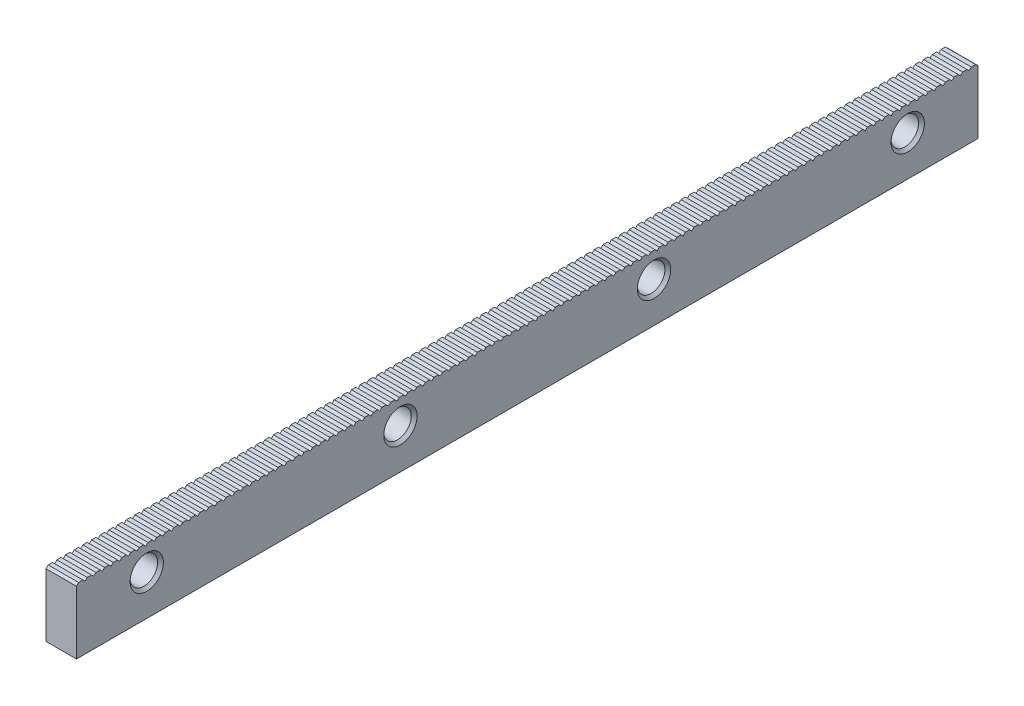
SolidWorks part; units mm, degrees
ref_plane "Front Plane" through (0, 0, 0) normal (0, 0, 1) x (1, 0, 0)
ref_plane "Top Plane" through (0, 0, 0) normal (0, 1, 0) x (1, 0, 0)
ref_plane "Right Plane" through (0, 0, 0) normal (1, 0, 0) x (0, 0, -1)
sketch "Sketch1" plane through (0, 0, 0) normal (1, 0, 0) x (0, 0, -1)
  line L1 (62.2, -4.5) -> (-62.2, -4.5)
  line L2 (62.2, -4.5) -> (62.2, 4.5)
  line L3 (62.2, 4.5) -> (-62.2, 4.5)
  line L4 (-62.2, -4.5) -> (-62.2, 4.5)
  line L5 (62.2, -4.5) -> (-62.2, 4.5) construction
  line L6 (62.2, 4.5) -> (-62.2, -4.5) construction
  point P0 (0, 0)
  dimension "D1" = 124.4
  dimension "D2" = 9
extrude "Boss-Extrude1" add sketch "Sketch1" along normal mid plane 4.2
sketch "Sketch2" plane through (0, 0, 0) normal (1, 0, 0) x (0, 0, -1)
  line L0 (-62.2, 4.2) -> (-62.5, 4.5)
  line L1 (-62.2, 4.5) -> (-62.2, -4.5) construction
  line L2 (-62.5, 4.5) -> (-61.9, 4.5)
  line L3 (62.2, 4.5) -> (-62.2, 4.5) construction
  line L4 (-61.9, 4.5) -> (-62.2, 4.2)
  line L5 (-62.2, -4.5) -> (62.2, -4.5) construction
  point P8 (-62.2, 4.2)
  dimension "D1" = 8.7
extrude "Cut-Extrude1" cut sketch "Sketch2" against normal mid plane 4.2
pattern_linear "LPattern1" count 105 spacing 1.196 along (0, -0.7071, -0.7071) of "Cut-Extrude1"
sketch "Sketch3" plane through (0, 0, 0) normal (1, 0, 0) x (0, 0, -1)
  line L0 (-62.2, -4.5) -> (62.2, -4.5) construction
  line L1 (-62.2, 4.2) -> (-62.2, -4.5) construction
  circle A0 centre (-52.5, 1.04) radius 1.9
  dimension "D3" = 3.8
  dimension "D1" = 5.54
  dimension "D2" = 9.7
extrude "Cut-Extrude2" cut sketch "Sketch3" against normal mid plane 4.2
chamfer "Chamfer1" distance 0.4 angle 45 2 edges at (-2.1, 1.04, 50.6) (2.1, 1.04, 50.6)
pattern_linear "LPattern2" count 4 spacing 35 along (0, 0, -1) of "Cut-Extrude2", "Chamfer1"
